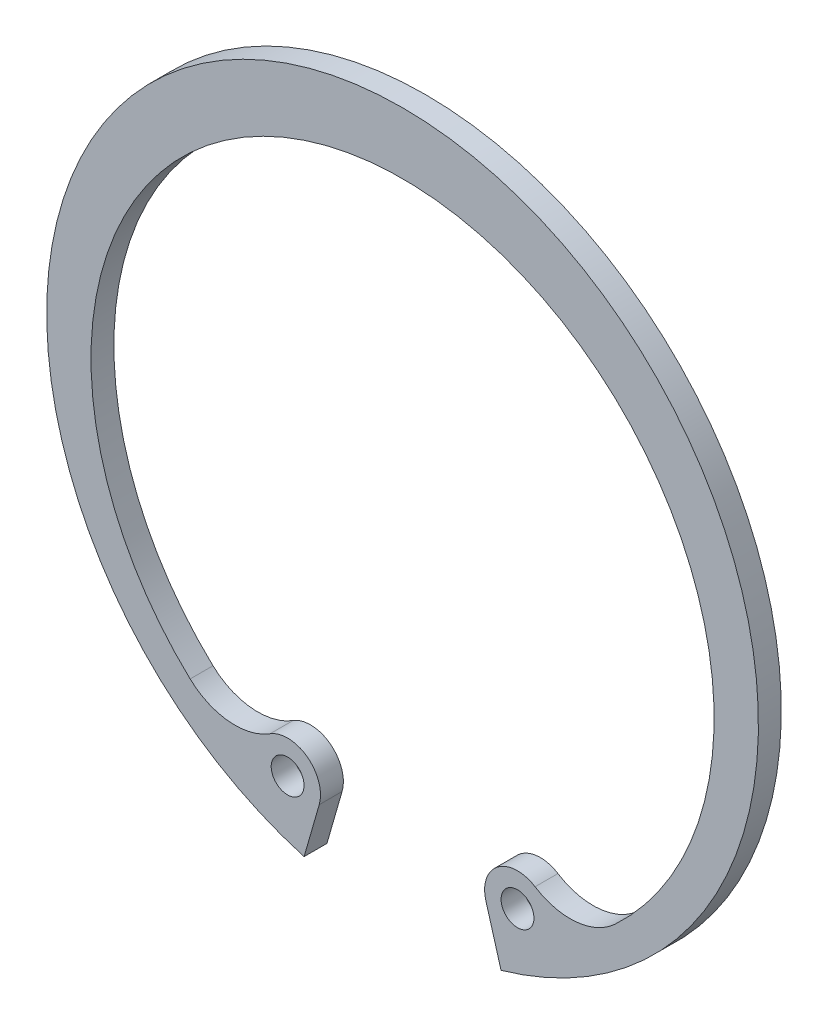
SolidWorks part; units mm, degrees
ref_plane "Plane1" through (0, 0, 0) normal (0, 0, 1) x (1, 0, 0)
ref_plane "Plane2" through (0, 0, 0) normal (0, 1, 0) x (1, 0, 0)
ref_plane "Plane3" through (0, 0, 0) normal (1, 0, 0) x (0, 0, -1)
extrude "Body" add sketch "BodySke" against normal blind 1.6
sketch "BodySke" plane through (0, 0, 0) normal (0, 0, 1) x (1, 0, 0)
  line L0 (-1.5431, 0) -> (1.5431, 0) construction
  line L1 (0, 0) -> (0, 20.6) construction
  line L2 (6.891, -23.9275) -> (5.8324, -20.2517)
  line L3 (-6.891, -23.9275) -> (-5.8324, -20.2517)
  line L4 (0, 0) -> (16.1371, -18.9633) construction
  line L5 (0, 0) -> (-16.1371, -18.9633) construction
  line L6 (-7.7244, -18.5101) -> (-8.3609, -20.7203) construction
  line L7 (7.8349, -18.8939) -> (8.2503, -20.3365) construction
  arc A0 (-5.8324, -20.2517) -> (-9.271, -17.6707) centre (-8.0426, -19.6152) ccw
  arc A1 (9.271, -17.6707) -> (5.8324, -20.2517) centre (8.0426, -19.6152) ccw
  arc A2 (14.7113, -17.2878) -> (-14.7113, -17.2878) centre (0, -1.2) ccw construction
  arc A3 (6.891, -23.9275) -> (-6.891, -23.9275) centre (0, 0) ccw
  circle A4 centre (8.0426, -19.6152) radius 1.15
  circle A5 centre (-8.0426, -19.6152) radius 1.15
  arc A7 (14.8642, -17.1466) -> (-14.8642, -17.1466) centre (0, -1.2) ccw
  arc A8 (-8.0426, -19.6152) -> (8.0426, -19.6152) centre (0, 0) ccw construction
  arc A9 (-14.8642, -17.1466) -> (-9.271, -17.6707) centre (-11.7278, -13.7817) ccw
  arc A10 (9.271, -17.6707) -> (14.8642, -17.1466) centre (11.7278, -13.7817) ccw
  dimension "GrooveDia" = 49.8
  dimension "TipRad" = 2.3
  dimension "HoleOffsetRad" = 21.2
  dimension "HoleDia" = 2.3
  dimension "FilletRad" = 4.6
  dimension "LargeRad" = 20.6
  dimension "SmallRad" = 22.7
  dimension "SmallAngle" = 80.793
  dimension "GapAngle" = 32.133
sketch "Clipboard" plane through (0, 0, 0) normal (0, 0, 1) x (1, 0, 0)
  line L0 (0, 0) -> (4.3, 0)
  line L1 (0, 0) -> (0, 2.2)
  line L2 (0, 0) -> (0, -6)
  circle A0 centre (0, 0) radius 1.15
  circle A1 centre (0, 0) radius 23.5
  dimension "HoleDia" = 2.3
  dimension "BoreDia" = 47
  dimension "LargeSection" = 4.3
  dimension "SmallSection" = 2.2
  dimension "LugSection" = 6
sketch "ModLugSke" plane through (0, 0, 0) normal (0, 0, 1) x (1, 0, 0)
  line L0 (6.891, -23.9275) -> (5.5397, -19.2352)
  line L1 (-6.891, -23.9275) -> (-5.5397, -19.2352)
  line L2 (12.4494, -14.2205) -> (16.4016, -18.7349) construction
  line L3 (-12.4494, -14.2205) -> (-16.4016, -18.7349) construction
  line L4 (-6.891, -23.9275) -> (-5.8324, -20.2517) construction
  line L5 (5.8324, -20.2517) -> (6.891, -23.9275) construction
  line L6 (0, 0) -> (0, -12.7358) construction
  line L7 (14.9429, -17.0687) -> (16.4016, -18.7349)
  line L8 (-16.4016, -18.7349) -> (-14.9429, -17.0687)
  arc A0 (6.891, -23.9275) -> (16.4016, -18.7349) centre (0, 0) ccw
  arc A1 (-8.5915, -16.8344) -> (-6.2636, -17.8319) centre (0, 0) ccw
  arc A2 (6.891, -23.9275) -> (-6.891, -23.9275) centre (0, 0) ccw construction
  arc A3 (9.271, -17.6707) -> (5.8324, -20.2517) centre (8.0426, -19.6152) ccw construction
  arc A4 (-8.5915, -16.8344) -> (-9.8914, -17.011) centre (-9.1143, -17.8587) ccw
  arc A5 (-14.9429, -17.0687) -> (-9.8914, -17.011) centre (-12.4494, -14.2205) ccw
  arc A6 (14.8642, -17.1466) -> (-14.8642, -17.1466) centre (0, -1.2) ccw construction
  arc A7 (9.8914, -17.011) -> (14.9429, -17.0687) centre (12.4494, -14.2205) ccw
  arc A8 (6.2636, -17.8319) -> (8.5915, -16.8344) centre (0, 0) ccw
  arc A9 (-16.4016, -18.7349) -> (-6.891, -23.9275) centre (0, 0) ccw
  circle A10 centre (-8.0426, -19.6152) radius 1.15
  circle A11 centre (-8.0426, -19.6152) radius 1.15 construction
  circle A12 centre (8.0426, -19.6152) radius 1.15
  circle A13 centre (8.0426, -19.6152) radius 1.15 construction
  arc A14 (-6.2636, -17.8319) -> (-5.5397, -19.2352) centre (-6.6448, -18.9169) cw
  arc A15 (6.2636, -17.8319) -> (5.5397, -19.2352) centre (6.6448, -18.9169) ccw
  arc A16 (8.5915, -16.8344) -> (9.8914, -17.011) centre (9.1143, -17.8587) cw
  point P43 (5.2306, -18.1618)
  dimension "LugAng" = 54.076
extrude "ModLug" [suppressed] add sketch "ModLugSke" against normal through all
equation "' \"BoreDia@Clipboard\" = 8"
equation "' \"Thickness@Body\" = 0.4"
equation "' \"GrooveDia@BodySke\" = 8.4"
equation "' \"LugSection@Clipboard\" = 1.7"
equation "' \"LargeSection@Clipboard\" = 0.85"
equation "' \"SmallSection@Clipboard\" = 0.45"
equation "' \"HoleDia@Clipboard\" = 0.8"
equation "' \"BoreDia@Clipboard\" = 25"
equation "' \"Thickness@Body\" = 1.1"
equation "' \"GrooveDia@BodySke\" = 26.6"
equation "' \"LugSection@Clipboard\" = 4"
equation "' \"LargeSection@Clipboard\" = 2.6"
equation "' \"SmallSection@Clipboard\" = 1.3"
equation "' \"HoleDia@Clipboard\" = 1.5"
equation "\"TipRad@BodySke\" = (\"LugSection@Clipboard\" - (\"GrooveDia@BodySke\" / 2  -  \"BoreDia@Clipboard\" / 2 ) ) / 2"
equation "\"HoleOffsetRad@BodySke\" = (\"GrooveDia@BodySke\" / 2) - \"LugSection@Clipboard\"  + \"TipRad@BodySke\""
equation "\"LargeRad@BodySke\" =  \"GrooveDia@BodySke\" / 2 -  \"LargeSection@Clipboard\""
equation "\"SmallRad@BodySke\" =  \"GrooveDia@BodySke\" / 2 -  \"SmallSection@Clipboard\""
equation "\"HoleDia@BodySke\" =  \"HoleDia@Clipboard\""
equation "\"FilletRad@BodySke\" = \"TipRad@BodySke\" * 2"
equation "\"GapAngle@BodySke\" = 360 - 0.965 * 360 * ( \"BoreDia@Clipboard\" /  \"GrooveDia@BodySke\")"
equation "\"LugAng@ModLugSke\" = \"GapAngle@BodySke\"  + 1.5 * 360 * (\"LugSection@Clipboard\" / (\"BoreDia@Clipboard\" * 3.1416))"
